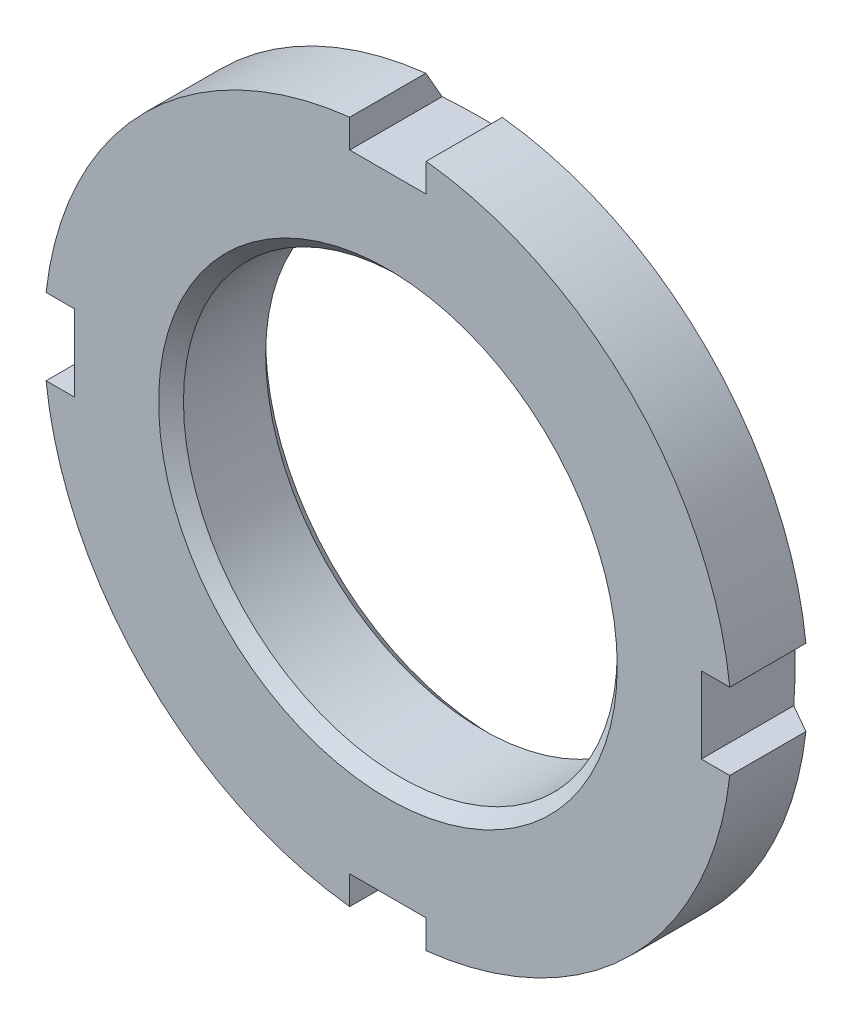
SolidWorks part; units mm, degrees
ref_plane "Front X-Y" through (0, 0, 0) normal (0, 0, 1) x (1, 0, 0)
ref_plane "Top X-Z" through (0, 0, 0) normal (0, 1, 0) x (1, 0, 0)
ref_plane "Right Y-Z" through (0, 0, 0) normal (1, 0, 0) x (0, 0, -1)
ref_plane "Plane1" through (0, 0, 0) normal (1, 0, 0) x (0, 0, -1)
sketch "Sketch1" plane through (0, 0, 0) normal (1, 0, 0) x (0, 0, -1)
  line L0 (0, 22.5) -> (0, 15)
  line L1 (0, 15) -> (0.812, 14.188)
  line L2 (0.812, 14.188) -> (6.188, 14.188)
  line L3 (6.188, 14.188) -> (7, 15)
  line L4 (7, 15) -> (7, 19)
  line L5 (7, 19) -> (4.9793, 22.5)
  line L6 (4.9793, 22.5) -> (0, 22.5)
  line L7 (7, 0) -> (0, 0) construction
revolve "Revolve1" add sketch "Sketch1" angle 360 about L7
ref_plane "Plane2" through (0, 0, 0) normal (0, 0, 1) x (1, 0, 0)
sketch "Sketch2" plane through (0, 0, 0) normal (0, 0, 1) x (1, 0, 0)
  line L0 (-34.525, 2.5) -> (-20.5, 2.5)
  line L1 (-20.5, 2.5) -> (-20.5, -2.5)
  line L2 (-20.5, -2.5) -> (-34.525, -2.5)
  line L3 (-2.5, -34.525) -> (-2.5, -20.5)
  line L4 (-2.5, -20.5) -> (2.5, -20.5)
  line L5 (2.5, -20.5) -> (2.5, -34.525)
  line L6 (34.525, -2.5) -> (20.5, -2.5)
  line L7 (20.5, -2.5) -> (20.5, 2.5)
  line L8 (20.5, 2.5) -> (34.525, 2.5)
  line L9 (2.5, 34.525) -> (2.5, 20.5)
  line L10 (2.5, 20.5) -> (-2.5, 20.5)
  line L11 (-2.5, 20.5) -> (-2.5, 34.525)
  circle A0 centre (0, 0) radius 45
  arc A1 (-34.525, -2.5) -> (-2.5, -34.525) centre (0, 0) ccw
  arc A2 (2.5, -34.525) -> (34.525, -2.5) centre (0, 0) ccw
  arc A3 (34.525, 2.5) -> (2.5, 34.525) centre (0, 0) ccw
  arc A4 (-2.5, 34.525) -> (-34.525, 2.5) centre (0, 0) ccw
extrude "Cut-Extrude1" cut sketch "Sketch2" against normal blind 7
